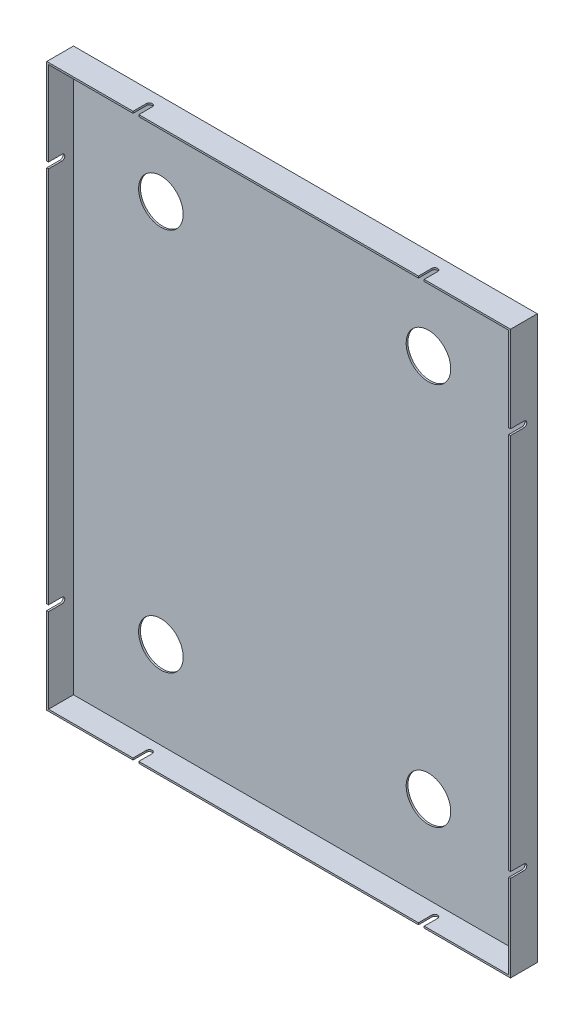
SolidWorks part; units mm, degrees
ref_plane "前基準面" through (0, 0, 0) normal (0, 0, 1) x (1, 0, 0)
ref_plane "上基準面" through (0, 0, 0) normal (0, 1, 0) x (1, 0, 0)
ref_plane "右基準面" through (0, 0, 0) normal (1, 0, 0) x (0, 0, -1)
sketch "草圖1" plane through (0, 0, 0) normal (0, 0, 1) x (1, 0, 0)
  line L1 (0, 0) -> (520, 0)
  line L2 (0, 0) -> (0, -630)
  line L3 (0, -630) -> (520, -630)
  line L4 (520, 0) -> (520, -630)
  dimension "D1" = 520
  dimension "D2" = 630
extrude "填料-伸長1" add sketch "草圖1" along normal blind 30
shell "薄殼1" thickness 2
sketch "草圖3" plane through (0, 0, 0) normal (0, 0, -1) x (-1, 0, 0)
  line L0 (0, 0) -> (0, -630) construction
  line L1 (-520, 0) -> (0, 0) construction
  line L2 (0, -630) -> (-520, -630) construction
  circle A0 centre (-100, -100) radius 25
  circle A1 centre (-400, -100) radius 25
  circle A2 centre (-100, -530) radius 25
  circle A3 centre (-400, -530) radius 25
  dimension "D1" = 50
  dimension "D2" = 50
  dimension "D6" = 50
  dimension "D7" = 50
  dimension "D3" = 300
  dimension "D4" = 100
  dimension "D5" = 100
  dimension "D8" = 300
  dimension "D9" = 100
  dimension "D10" = 100
extrude "除料-伸長2" cut sketch "草圖3" against normal up to next
sketch "草圖4" plane through (520, 0, 0) normal (1, 0, 0) x (0, 0, -1)
  line L0 (-30, -530) -> (-15, -530) construction
  line L2 (-30, -630) -> (-30, 0) construction
  line L3 (-30, -526.75) -> (-15, -526.75)
  line L4 (-30, -533.25) -> (-15, -533.25)
  line L5 (-15, -100) -> (-30, -100) construction
  line L6 (-15, -103.25) -> (-30, -103.25)
  line L9 (-15, -96.75) -> (-30, -96.75)
  line L10 (-30, 0) -> (0, 0) construction
  line L11 (-30, -630) -> (0, -630) construction
  arc A0 (-30, -526.75) -> (-30, -533.25) centre (-30, -530) ccw
  arc A1 (-15, -533.25) -> (-15, -526.75) centre (-15, -530) ccw
  arc A2 (-15, -103.25) -> (-15, -96.75) centre (-15, -100) ccw
  arc A3 (-30, -96.75) -> (-30, -103.25) centre (-30, -100) ccw
  point P4 (-22.5, -530)
  point P11 (-22.5, -100)
  dimension "D1" = 15
  dimension "D2" = 3.25
  dimension "D3" = 3.25
  dimension "D4" = 15
  dimension "D5" = 100
  dimension "D6" = 100
extrude "除料-伸長4" cut sketch "草圖4" against normal through all
sketch "草圖5" plane through (0, 0, 0) normal (0, 1, 0) x (1, 0, 0)
  line L0 (100, -30) -> (100, -15) construction
  line L1 (520, -30) -> (0, -30) construction
  line L2 (96.75, -30) -> (96.75, -15)
  line L3 (103.25, -30) -> (103.25, -15)
  line L4 (0, -30) -> (0, 0) construction
  line L5 (420, -30) -> (420, -15) construction
  line L6 (416.75, -30) -> (416.75, -15)
  line L7 (423.25, -30) -> (423.25, -15)
  line L8 (520, -30) -> (520, 0) construction
  arc A0 (96.75, -30) -> (103.25, -30) centre (100, -30) ccw
  arc A1 (103.25, -15) -> (96.75, -15) centre (100, -15) ccw
  arc A2 (416.75, -30) -> (423.25, -30) centre (420, -30) ccw
  arc A3 (423.25, -15) -> (416.75, -15) centre (420, -15) ccw
  point P4 (100, -22.5)
  point P13 (420, -22.5)
  dimension "D1" = 3.25
  dimension "D4" = 3.25
  dimension "D2" = 15
  dimension "D3" = 100
  dimension "D5" = 15
  dimension "D6" = 100
extrude "除料-伸長5" cut sketch "草圖5" against normal through all
